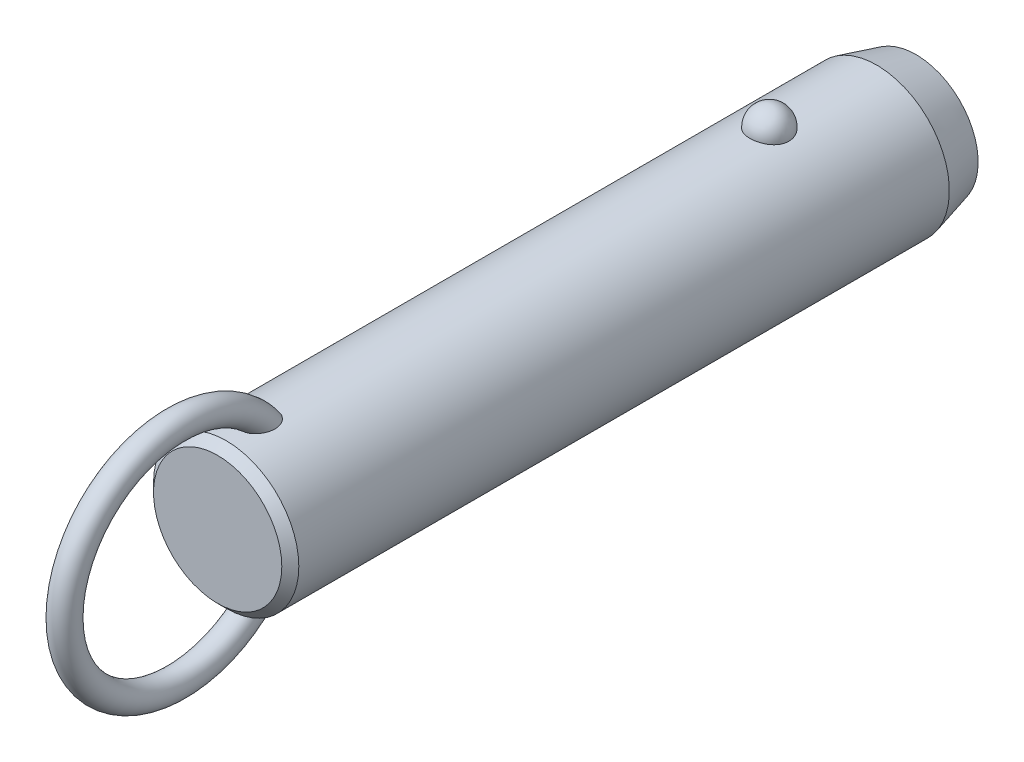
SolidWorks part; units mm, degrees
ref_plane "Front Plane" through (0, 0, 0) normal (0, 0, 1) x (1, 0, 0)
ref_plane "Top Plane" through (0, 0, 0) normal (0, 1, 0) x (1, 0, 0)
ref_plane "Right Plane" through (0, 0, 0) normal (1, 0, 0) x (0, 0, -1)
sketch "Sketch2" plane through (0, 0, 0) normal (0, 0, 1) x (1, 0, 0)
  circle A0 centre (0, 0) radius 11.1
  point P3 (0, 11.1)
  dimension "D1" = 22.2
extrude "Boss-Extrude1" add sketch "Sketch2" along normal blind 68.6
sketch "Sketch3" plane through (0, 0, 0) normal (0, 0, -1) x (-1, 0, 0)
  circle A0 centre (0, 0) radius 11.1
  dimension "D1" = 22.2
extrude "Boss-Extrude2" add sketch "Sketch3" along normal blind 25.4
chamfer "Chamfer1" distance 6 angle 15 1 edges at (-11.1, 0, -25.4)
sketch "Sketch12" plane through (0, 0, 0) normal (1, 0, 0) x (0, 0, -1)
  line L0 (-68.6, 11.1) -> (-68.6, -11.1) construction
  point P0 (-68.6, 0)
sketch "Sketch13" plane through (0, 0, 0) normal (1, 0, 0) x (0, 0, -1)
  circle A0 centre (-87.65, 0) radius 19.05
  point P2 (-68.6, 0)
  dimension "D1" = 38.1
sketch "Sketch14" plane through (0, 0, 0) normal (0, 1, 0) x (1, 0, 0)
  circle A0 centre (0, -70.6) radius 2
  point P2 (0, -68.6)
  dimension "D1" = 4
sweep "Sweep1" add profiles "Sketch14" path "Sketch13"
sketch "Sketch15" plane through (0, 0, 68.6) normal (0, 0, 1) x (1, 0, 0)
  circle A0 centre (0, 0) radius 11.1
  dimension "D1" = 22.2
extrude "Boss-Extrude3" add sketch "Sketch15" along normal blind 12.7
chamfer "Chamfer2" distance 1.3 angle 45 1 edges at (11.1, 0, 81.3)
sketch "Sketch18" plane through (0, 0, 0) normal (1, 0, 0) x (0, 0, -1)
  line L0 (19.4, 11.1) -> (-72.168, 11.1) construction
  line L1 (3, 14.1) -> (3, 8.1)
  line L2 (-72.168, -11.1) -> (19.4, -11.1) construction
  arc A0 (3, 14.1) -> (3, 8.1) centre (3, 11.1) ccw
  point P4 (0, 11.1)
  dimension "D1" = 25.2
revolve "Revolve1" add sketch "Sketch18" angle 360 about L1
